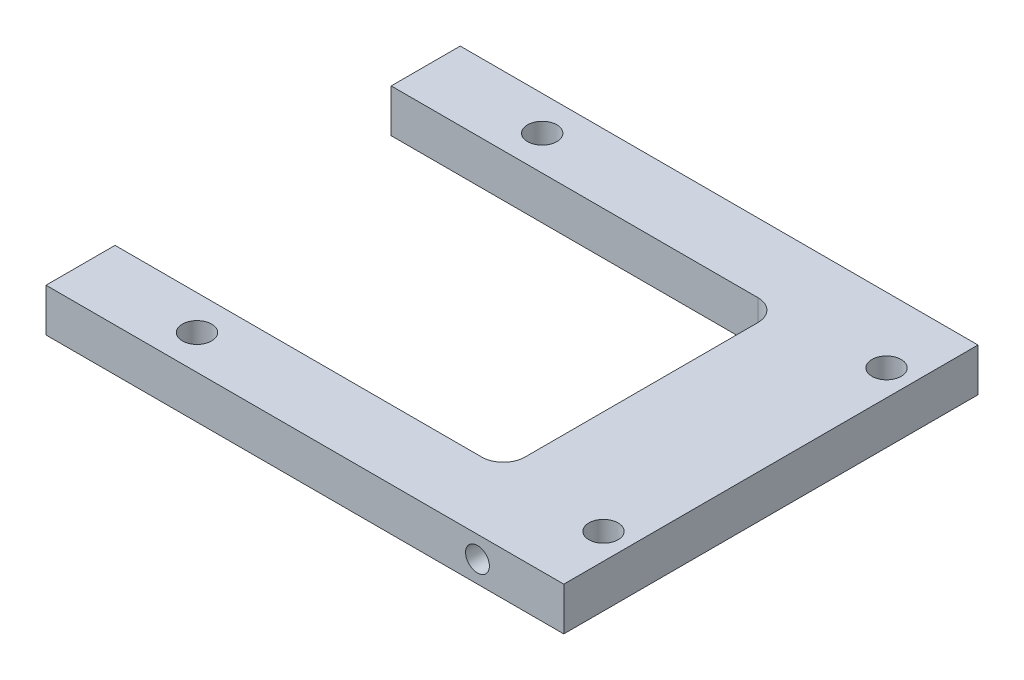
SolidWorks part; units mm, degrees
ref_plane "Front Plane" through (0, 0, 0) normal (0, 0, 1) x (1, 0, 0)
ref_plane "Top Plane" through (0, 0, 0) normal (0, 1, 0) x (1, 0, 0)
ref_plane "Right Plane" through (0, 0, 0) normal (1, 0, 0) x (0, 0, -1)
sketch "Sketch1" plane through (0, 0, 0) normal (0, 1, 0) x (1, 0, 0)
  line L1 (-43.7303, 31.8783) -> (32.4697, 31.8783)
  line L2 (-43.7303, 31.8783) -> (-43.7303, -29.0817)
  line L3 (-43.7303, -29.0817) -> (32.4697, -29.0817)
  line L4 (32.4697, 31.8783) -> (32.4697, -29.0817)
  dimension "D1" = 60.96
  dimension "D2" = 76.2
extrude "Extrude1" add sketch "Sketch1" along normal blind 6.35
sketch "Sketch2" plane through (0, 6.35, 0) normal (0, 1, 0) x (1, 0, 0)
  line L0 (-43.7303, 1.3983) -> (32.4697, 1.3983) construction
  line L1 (-26.5853, 31.8783) -> (-26.5853, -29.0817) construction
  line L2 (-43.7303, -29.0817) -> (32.4697, -29.0817) construction
  line L3 (32.4697, 31.8783) -> (-43.7303, 31.8783) construction
  line L4 (-43.7303, 31.8783) -> (-43.7303, -29.0817) construction
  line L5 (32.4697, -29.0817) -> (32.4697, 31.8783) construction
  line L6 (28.6597, 31.8783) -> (28.6597, -29.0817) construction
  circle A0 centre (-26.5853, -24.0017) radius 2.1526
  circle A1 centre (-26.5853, 26.7983) radius 2.1526
  circle A2 centre (28.6597, -19.4297) radius 2.1526
  circle A3 centre (28.6597, 22.2263) radius 2.1526
  dimension "D2" = 4.3053
  dimension "D5" = 4.3053
  dimension "D1" = 17.145
  dimension "D3" = 50.8
  dimension "D4" = 72.39
  dimension "D6" = 41.656
extrude "Cut-Extrude1" cut sketch "Sketch2" against normal through all
sketch "Sketch3" plane through (0, 0, 29.0817) normal (0, 0, 1) x (1, 0, 0)
  line L0 (-43.7303, 3.175) -> (32.4697, 3.175) construction
  line L1 (32.4697, 6.35) -> (32.4697, 0) construction
  line L2 (-43.7303, 6.35) -> (-43.7303, 0) construction
  circle A0 centre (19.7697, 3.175) radius 1.7526
  dimension "D1" = 3.5052
  dimension "D2" = 63.5
extrude "Cut-Extrude2" cut sketch "Sketch3" against normal blind 12.7
sketch "Sketch4" plane through (0, 6.35, 0) normal (0, 1, 0) x (1, 0, 0)
  line L0 (-43.7303, 21.7183) -> (13.4197, 21.7183)
  line L1 (13.4197, -18.9217) -> (-43.7303, -18.9217)
  line L2 (13.4197, 21.7183) -> (13.4197, -18.9217)
  line L3 (32.4697, 31.8783) -> (-43.7303, 31.8783) construction
  line L4 (-43.7303, -29.0817) -> (32.4697, -29.0817) construction
  line L5 (-43.7303, 31.8783) -> (-43.7303, -29.0817) construction
  dimension "D1" = 10.16
  dimension "D2" = 10.16
  dimension "D3" = 57.15
extrude "Cut-Extrude5" cut sketch "Sketch4" against normal through all and the other way through all flip side to cut
fillet "Fillet1" radius 3.175 2 edges at (13.4197, 3.175, 18.9217) (13.4197, 3.175, -21.7183)
